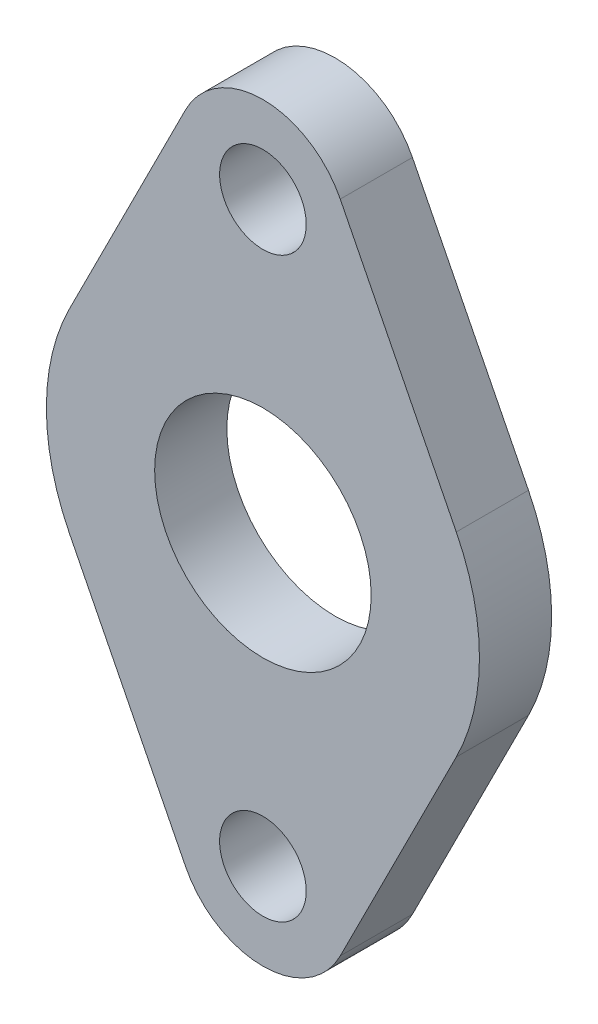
SolidWorks part; units mm, degrees
ref_plane "Front Plane" through (0, 0, 0) normal (0, 0, 1) x (1, 0, 0)
ref_plane "Top Plane" through (0, 0, 0) normal (0, 1, 0) x (1, 0, 0)
ref_plane "Right Plane" through (0, 0, 0) normal (1, 0, 0) x (0, 0, -1)
sketch "Sketch1" plane through (0, 0, 0) normal (0, 0, 1) x (1, 0, 0)
  line L0 (0, 0) -> (23.2855, 0) construction
  line L1 (-6.8049, 28.829) -> (-17.0122, 8.5725)
  line L2 (6.8049, 28.829) -> (17.0122, 8.5725)
  line L3 (-17.0122, -8.5725) -> (-6.8049, -28.829)
  line L4 (6.8049, -28.829) -> (17.0122, -8.5725)
  circle A0 centre (0, 0) radius 9.525
  arc A1 (-17.0122, 8.5725) -> (-17.0122, -8.5725) centre (0, 0) ccw
  circle A2 centre (0, 25.4) radius 3.81
  arc A3 (6.8049, 28.829) -> (-6.8049, 28.829) centre (0, 25.4) ccw
  circle A4 centre (0, -25.4) radius 3.81
  arc A5 (-6.8049, -28.829) -> (6.8049, -28.829) centre (0, -25.4) ccw
  arc A6 (17.0122, -8.5725) -> (17.0122, 8.5725) centre (0, 0) ccw
  dimension "D1" = 19.05
  dimension "D2" = 19.05
  dimension "D4" = 7.62
  dimension "D5" = 7.62
  dimension "D3" = 50.8
extrude "Boss-Extrude1" add sketch "Sketch1" along normal blind 6.35
